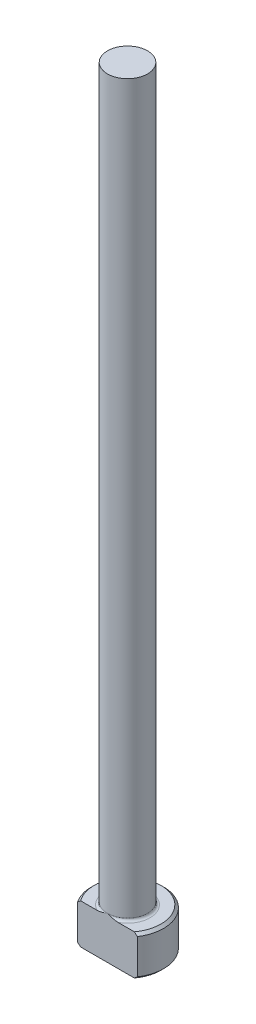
SolidWorks part; units mm, degrees
ref_plane "Front Plane" through (0, 0, 0) normal (0, 0, 1) x (1, 0, 0)
ref_plane "Top Plane" through (0, 0, 0) normal (0, 1, 0) x (1, 0, 0)
ref_plane "Right Plane" through (0, 0, 0) normal (1, 0, 0) x (0, 0, -1)
sketch "Sketch1" plane through (0, 0, 0) normal (0, 0, 1) x (1, 0, 0)
  line L0 (0, 259.9588) -> (0, -15.1925) construction
  line L1 (0, 0) -> (-3.5687, 0)
  line L2 (-3.5687, 0) -> (-3.5687, 3.9624)
  line L3 (-3.5687, 3.9624) -> (-1.9837, 3.9624)
  line L4 (-1.9837, 3.9624) -> (-1.9837, 76.2)
  line L5 (-1.9837, 76.2) -> (0, 76.2)
  line L6 (0, 76.2) -> (0, 0)
  dimension "L" = 76.2
  dimension "H" = 7.1374
  dimension "T" = 3.9624
  dimension "D" = 3.9675
revolve "Revolve1" add sketch "Sketch1" angle 360 about L0
chamfer "Chamfer1" distance 0.254 angle 45 2 edges at (0, 3.9624, 3.5687) (0, 0, 3.5687)
fillet "Fillet1" radius 0.254 1 edges at (0, 3.9624, 1.9837)
sketch "Sketch2" plane through (0, 0, 0) normal (0, -1, 0) x (1, 0, 0)
  line L0 (-2.9665, 1.9837) -> (2.9665, 1.9837)
  arc A0 (2.9665, 1.9837) -> (-2.9665, 1.9837) centre (0, 0) ccw
  circle A1 centre (0, 0) radius 3.5687 construction
  circle A3 centre (0, 0) radius 1.9837 construction
extrude "KEY" cut sketch "Sketch2" against normal through all
sketch "Pocket Sketch" plane through (0, 0, 0) normal (0, 0, 1) x (1, 0, 0)
  line L0 (-3.9656, 0) -> (-3.9656, 3.9878)
  line L1 (-3.9656, 3.9878) -> (-2.9442, 3.9878)
  line L2 (-2.1822, 4.7498) -> (-2.1822, 22.225)
  line L3 (-2.1822, 22.225) -> (0, 22.225)
  line L4 (0, 22.225) -> (0, 0)
  line L5 (0, 0) -> (-3.9656, 0)
  line L6 (0, 12.6104) -> (0, -2.4989) construction
  line L7 (-3.5687, 3.7084) -> (-3.5687, 0.254) construction
  line L8 (3.3147, 3.9624) -> (-3.3147, 3.9624) construction
  line L9 (-1.9837, 76.2) -> (-1.9837, 4.2164) construction
  line L10 (-2.9442, 3.9878) -> (-2.1822, 4.7498)
  point P3 (-2.1822, 3.9878)
  dimension "D1" = 7.9311
  dimension "D2" = 0.3969
  dimension "D3" = 0.0254
  dimension "D4" = 0.1984
  dimension "D5" = 4.3644
  dimension "D6" = 22.225
